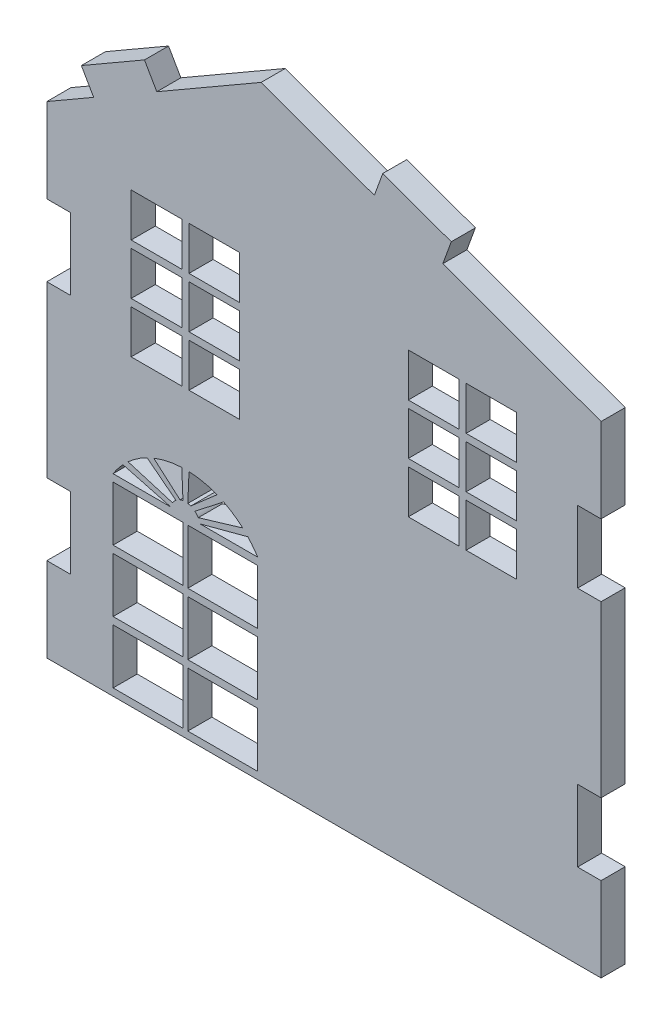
SolidWorks part; units mm, degrees
ref_plane "Front Plane" through (0, 0, 0) normal (0, 0, 1) x (1, 0, 0)
ref_plane "Top Plane" through (0, 0, 0) normal (0, 1, 0) x (1, 0, 0)
ref_plane "Right Plane" through (0, 0, 0) normal (1, 0, 0) x (0, 0, -1)
sketch "Sketch1" plane through (0, 0, 0) normal (0, 0, 1) x (1, 0, 0)
  line L0 (-141.0684, 341.3573) -> (-141.0684, -392.4318) construction
  line L1 (0, 0) -> (-142.5, 0)
  line L2 (0, 200) -> (0, 165)
  line L3 (-202.5, 80) -> (-178.573, 80)
  line L4 (-230, 0) -> (-230, 35)
  line L5 (-230, 200) -> (-210.5583, 211.2247)
  line L6 (-360.3283, 100) -> (116.8057, 100) construction
  line L7 (-115, 0) -> (-115, 210) construction
  line L8 (-94.0838, 234.2437) -> (-90.5815, 243.8661)
  line L9 (-202.5, 3) -> (-202.5, 25.6667)
  line L10 (-202.5, 0) -> (-230, 0)
  line L11 (-142.5, 3) -> (-142.5, 25.6667)
  line L12 (-195, 185.7344) -> (-174, 185.7344)
  line L13 (-195, 185.7344) -> (-195, 167.7344)
  line L14 (-195, 125.7344) -> (-174, 125.7344)
  line L15 (-150, 185.7344) -> (-150, 167.7344)
  line L16 (-230, 165) -> (-220.24, 165)
  line L17 (-220.24, 135.24) -> (-220.24, 165)
  line L18 (-230, 135.24) -> (-220.24, 135.24)
  line L19 (-230, 165) -> (-230, 200)
  line L20 (0, 35) -> (-9.76, 35)
  line L21 (-210.5583, 211.2247) -> (-215.6783, 220.0928)
  line L22 (-9.76, 64.76) -> (-9.76, 35)
  line L23 (0, 64.76) -> (-9.76, 64.76)
  line L24 (0, 135.24) -> (-9.76, 135.24)
  line L25 (-230, 64.76) -> (-230, 135.24)
  line L26 (-9.76, 135.24) -> (-9.76, 165)
  line L27 (0, 165) -> (-9.76, 165)
  line L28 (-230, 64.76) -> (-220.24, 64.76)
  line L29 (-174, 185.7344) -> (-174, 167.7344)
  line L30 (-230, 35) -> (-220.24, 35)
  line L31 (-220.24, 64.76) -> (-220.24, 35)
  line L32 (-184.3697, 226.3447) -> (-189.4897, 235.2128)
  line L33 (-215.6783, 220.0928) -> (-189.4897, 235.2128)
  line L34 (-230, 0) -> (-202.5, 0) construction
  line L35 (-142.5, 0) -> (-115, 0) construction
  line L36 (-195, 167.7344) -> (-174, 167.7344)
  line L37 (-195, 164.7344) -> (-174, 164.7344)
  line L38 (-184.3697, 226.3447) -> (-141.0684, 251.3447)
  line L39 (-195, 146.7344) -> (-174, 146.7344)
  line L40 (-141.0684, 251.3447) -> (-94.0838, 234.2437)
  line L41 (0, 135.24) -> (0, 64.76)
  line L42 (0, 35) -> (0, 0)
  line L43 (-90.5815, 243.8661) -> (-62.1652, 233.5234)
  line L44 (-62.1652, 233.5234) -> (-65.6674, 223.901)
  line L45 (-65.6674, 223.901) -> (0, 200)
  line L46 (-171.4946, 3) -> (-142.5, 3)
  line L47 (-171.4946, 25.6667) -> (-171.4946, 3)
  line L48 (-202.5, 77) -> (-173.5054, 77)
  line L49 (-178.573, 80) -> (-198.4194, 85.284)
  line L50 (-196.2797, 87.3868) -> (-177.841, 81.8612)
  line L51 (-172.5, 96.502) -> (-172.5, 77) construction
  line L52 (-148.7203, 87.3868) -> (-167.159, 81.8612)
  line L53 (-166.427, 80) -> (-146.5806, 85.284)
  line L54 (-188.3785, 92.7828) -> (-176.4522, 83.4806)
  line L55 (-185.6413, 94.0106) -> (-174.7243, 84.4878)
  line L56 (-174, 96.502) -> (-173.5056, 84.8176)
  line L57 (-171, 96.502) -> (-171.4944, 84.8176)
  line L58 (-159.3587, 94.0106) -> (-170.2757, 84.4878)
  line L59 (-156.6215, 92.7828) -> (-168.5478, 83.4806)
  line L60 (-166.427, 80) -> (-142.5, 80)
  line L61 (-173.5054, 77) -> (-173.5054, 54.3333)
  line L62 (-173.5054, 3) -> (-202.5, 3)
  line L63 (-202.5, 54.3333) -> (-173.5054, 54.3333)
  line L64 (-202.5, 51.3333) -> (-173.5054, 51.3333)
  line L65 (-202.5, 28.6667) -> (-173.5054, 28.6667)
  line L66 (-202.5, 25.6667) -> (-173.5054, 25.6667)
  line L67 (-202.5, 54.3333) -> (-202.5, 77)
  line L68 (-173.5054, 51.3333) -> (-173.5054, 28.6667)
  line L69 (-173.5054, 25.6667) -> (-173.5054, 3)
  line L70 (-202.5, 28.6667) -> (-202.5, 51.3333)
  line L71 (-202.5, 0) -> (-142.5, 0)
  line L72 (-142.5, 25.6667) -> (-171.4946, 25.6667)
  line L73 (-142.5, 28.6667) -> (-171.4946, 28.6667)
  line L74 (-171.4946, 51.3333) -> (-171.4946, 28.6667)
  line L75 (-171.4946, 77) -> (-171.4946, 54.3333)
  line L76 (-142.5, 51.3333) -> (-171.4946, 51.3333)
  line L77 (-142.5, 54.3333) -> (-171.4946, 54.3333)
  line L78 (-171.4946, 77) -> (-142.5, 77)
  line L79 (-142.5, 54.3333) -> (-142.5, 77)
  line L80 (-142.5, 28.6667) -> (-142.5, 51.3333)
  line L81 (-172.5, 185.7344) -> (-172.5, 125.7344) construction
  line L82 (-195, 143.7344) -> (-174, 143.7344)
  line L83 (-195, 164.7344) -> (-195, 146.7344)
  line L84 (-195, 143.7344) -> (-195, 125.7344)
  line L85 (-174, 164.7344) -> (-174, 146.7344)
  line L86 (-174, 143.7344) -> (-174, 125.7344)
  line L87 (-171, 143.7344) -> (-171, 125.7344)
  line L88 (-150, 143.7344) -> (-171, 143.7344)
  line L89 (-150, 146.7344) -> (-171, 146.7344)
  line L90 (-171, 164.7344) -> (-171, 146.7344)
  line L91 (-171, 185.7344) -> (-171, 167.7344)
  line L92 (-150, 164.7344) -> (-171, 164.7344)
  line L93 (-150, 167.7344) -> (-171, 167.7344)
  line L94 (-171, 185.7344) -> (-150, 185.7344)
  line L95 (-150, 164.7344) -> (-150, 146.7344)
  line L96 (-150, 143.7344) -> (-150, 125.7344)
  line L97 (-57.5, 185.7344) -> (-57.5, 125.7344) construction
  line L98 (-80, 143.7344) -> (-80, 125.7344)
  line L99 (-80, 164.7344) -> (-80, 146.7344)
  line L100 (-59, 185.7344) -> (-80, 185.7344)
  line L101 (-80, 167.7344) -> (-59, 167.7344)
  line L102 (-80, 164.7344) -> (-59, 164.7344)
  line L103 (-59, 185.7344) -> (-59, 167.7344)
  line L104 (-59, 164.7344) -> (-59, 146.7344)
  line L105 (-80, 146.7344) -> (-59, 146.7344)
  line L106 (-80, 143.7344) -> (-59, 143.7344)
  line L107 (-59, 143.7344) -> (-59, 125.7344)
  line L108 (-56, 143.7344) -> (-56, 125.7344)
  line L109 (-56, 164.7344) -> (-56, 146.7344)
  line L110 (-35, 143.7344) -> (-35, 125.7344)
  line L111 (-35, 164.7344) -> (-35, 146.7344)
  line L112 (-35, 143.7344) -> (-56, 143.7344)
  line L113 (-35, 146.7344) -> (-56, 146.7344)
  line L114 (-35, 164.7344) -> (-56, 164.7344)
  line L115 (-35, 167.7344) -> (-56, 167.7344)
  line L116 (-56, 185.7344) -> (-56, 167.7344)
  line L117 (-80, 185.7344) -> (-80, 167.7344)
  line L118 (-35, 125.7344) -> (-56, 125.7344)
  line L119 (-35, 185.7344) -> (-35, 167.7344)
  line L120 (-35, 185.7344) -> (-56, 185.7344)
  line L121 (-171, 125.7344) -> (-150, 125.7344)
  line L122 (-59, 125.7344) -> (-80, 125.7344)
  arc A0 (-202.5, 80) -> (-198.4194, 85.284) centre (-172.5, 61.0499) cw
  arc A1 (-177.841, 81.8612) -> (-176.4522, 83.4806) centre (-172.5, 78.686) cw
  arc A2 (-196.2797, 87.3868) -> (-188.3785, 92.7828) centre (-172.5, 61.0499) cw
  arc A3 (-174.7243, 84.4878) -> (-173.5056, 84.8176) centre (-172.5, 78.686) cw
  arc A4 (-171.4944, 84.8176) -> (-170.2757, 84.4878) centre (-172.5, 78.686) cw
  arc A5 (-168.5478, 83.4806) -> (-167.159, 81.8612) centre (-172.5, 78.686) cw
  arc A6 (-185.6413, 94.0106) -> (-174, 96.502) centre (-172.5, 61.0499) cw
  arc A7 (-171, 96.502) -> (-159.3587, 94.0106) centre (-172.5, 61.0499) cw
  arc A8 (-156.6215, 92.7828) -> (-148.7203, 87.3868) centre (-172.5, 61.0499) cw
  arc A9 (-146.5806, 85.284) -> (-142.5, 80) centre (-172.5, 61.0499) cw
extrude "Boss-Extrude1" add sketch "Sketch1" along normal blind 10
equation "\"HeightHouse\" = \"SCALE\"*200mm"
equation "\"LenghtHouse\"=\"SCALE\"* 300mm"
equation "\"WidthHouse\"= \"SCALE\"*230mm"
equation "\"ThicknessMaterial\"=10mm"
equation "\"Kerf\"= 0.12mm"
equation "\"WidthWindows\"=\"SCALE\"* 45mm"
equation "\"WidthDoor\"=\"SCALE\"* 60mm"
equation "\"HeightDoor\"=\"SCALE\"* 80mm"
equation "\"D2@Sketch1\"=\"ThicknessMaterial\"-\"Kerf\"*2"
equation "\"LenghtJoints\" =\"SCALE\"* 30mm"
equation "\"D3@Sketch1\"=\"LenghtJoints\"-\"Kerf\"*2"
equation "\"D9@Sketch1\"=\"LenghtJoints\"+\"Kerf\"*2"
equation "\"D12@Sketch1\"=\"ThicknessMaterial\"+\"Kerf\"*2"
equation "\"D13@Sketch1\"=\"WidthHouse\""
equation "\"D10@Sketch1\"=\"HeightHouse\""
equation "\"D11@Sketch1\"=(\"HeightHouse\")/2"
equation "\"D14@Sketch1\"=\"WidthDoor\""
equation "\"D15@Sketch1\"=\"WidthWindows\""
equation "\"HeightWindows\"=\"SCALE\"* 60"
equation "\"D16@Sketch1\"=\"HeightWindows\""
equation "\"D18@Sketch1\"=\"HeightDoor\""
equation "\"DistanceForJointsRoof\"=\"SCALE\"* 50mm"
equation "\"D4@Sketch1\"=\"DistanceForJointsBody\""
equation "\"Roof1\"=\"SCALE\"* 115mm"
equation "\"Roof2\"=\"SCALE\"* 140mm"
equation "\"D1@Boss-Extrude1\"=\"ThicknessMaterial\""
equation "\"WidthWindowFrame\"=\"SCALE\"* 3mm"
equation "\"D17@Sketch1\"=\"WidthWindowFrame\""
equation "\"D19@Sketch1\"=\"WidthWindowFrame\""
equation "\"D20@Sketch1\"=\"WidthWindowFrame\"-1mm"
equation "\"D21@Sketch1\"=\"WidthWindowFrame\"-1"
equation "\"D23@Sketch1\"=\"WidthWindowFrame\""
equation "\"D24@Sketch1\"=\"WidthWindowFrame\""
equation "\"D25@Sketch1\"=\"WidthWindowFrame\""
equation "\"D26@Sketch1\"=\"WidthWindowFrame\""
equation "\"D27@Sketch1\"=\"WidthWindowFrame\""
equation "\"D28@Sketch1\"=\"WidthWindowFrame\""
equation "\"D29@Sketch1\"=\"WidthWindowFrame\"/2"
equation "\"DistanceForJointsBody\"=\"SCALE\"* 35mm"
equation "\"CornerRoofBig\"=70deg"
equation "\"CornerRoofSmall\"= 60deg"
equation "\"D6@Sketch1\"=\"CornerRoofBig\""
equation "\"D7@Sketch1\"=\"CornerRoofSmall\""
equation "\"D5@Sketch1\"=\"DistanceForJointsRoof\""
equation "\"D8@Sketch1\"=\"DistanceForJointsRoof\""
equation "\"D22@Sketch1\"=\"WidthWindowFrame\"/2"
equation "\"SCALE\"=1"
equation "\"LenghtRoof\"= \"LenghtHouse\"+(\"SCALE\"*40mm)"
equation "\"RoofSmall\"=\"SCALE\"* 120mm"
equation "\"RoofBig\"=\"SCALE\"* 170mm"
equation "\"TerraceLenght\"=\"SCALE\"* \"WidthWindows\"+35mm"
equation "\"TerraceHeight\"=\"SCALE\"* \"HeightWindows\"/2"
equation "\"TerraceWidth\"=\"SCALE\"* \"TerraceHeight\"+10mm"
equation "\"LenghtJointTerrace\"=\"SCALE\"* 10mm"
equation "\"DistanceJointForChimney\"= \"SCALE\"* 10mm"
equation "\"HeightChimney\"= \"SCALE\"* 35mm"
equation "\"WidthChimney\"=\"SCALE\"* 20mm"
equation "\"D30@Sketch1\"=\"SCALE\"*80mm"
